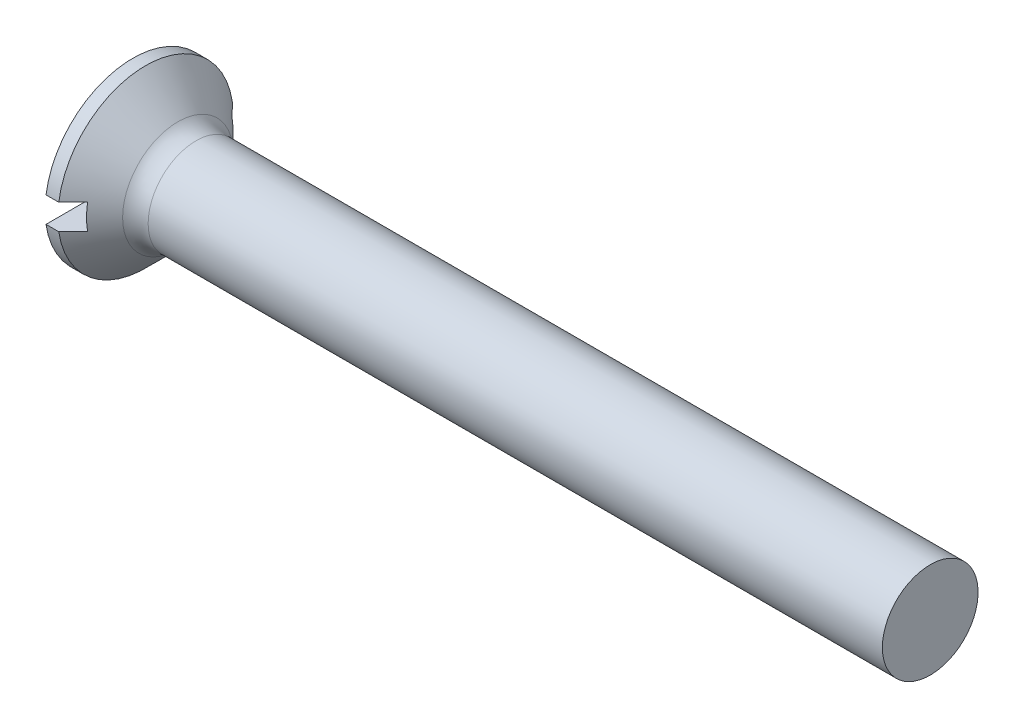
SolidWorks part; units mm, degrees
ref_plane "Plane1" through (0, 0, 0) normal (0, 0, 1) x (1, 0, 0)
ref_plane "Plane2" through (0, 0, 0) normal (0, 1, 0) x (1, 0, 0)
ref_plane "Plane3" through (0, 0, 0) normal (1, 0, 0) x (0, 0, -1)
sketch "BodySke" plane through (0, 0, 0) normal (0, 0, 1) x (1, 0, 0)
  line L0 (0, 0) -> (0, 2.75)
  line L1 (0, 2.75) -> (0.4, 2.75)
  line L2 (1.65, 1.5) -> (25, 1.5)
  line L3 (25, 1.5) -> (25, 0)
  line L4 (25, 0) -> (0, 0)
  line L5 (-6.35, 0) -> (82.55, 0) construction
  line L6 (1.65, -1.5) -> (25, -1.5) construction
  line L7 (0.4, -2.75) -> (1.65, -1.5) construction
  line L8 (0.4, 2.75) -> (1.65, 1.5)
  line L9 (0, -2.75) -> (0.4, -2.75) construction
  line L10 (2.15, 3.0875) -> (2.15, -6.4375) construction
  line L11 (0, 6.35) -> (0, -3.175) construction
  dimension "Diameter" = 3
  dimension "Length" = 25
  dimension "Head_ht" = 1.65
  dimension "Head_dia" = 5.5
  dimension "Head_ang" = 90
  dimension "D6" = 0.4
  dimension "Advance" = 0.5
  dimension "Thread_nom" = 25
revolve "Base-Revolve" add sketch "BodySke" angle 360 about L5
fillet "Fillet1" radius 0.8 1 edges at (1.65, 0, 1.5)
sketch "Sketch2" plane through (0, 0, 0) normal (-1, 0, 0) x (0, 0, 1)
  line L0 (-2.75, -0.4) -> (2.75, -0.4)
  line L1 (-2.75, -0.4) -> (-2.75, 0.4)
  line L2 (2.75, 0.4) -> (-2.75, 0.4)
  line L3 (2.75, 0.4) -> (2.75, -0.4)
  dimension "D1" = 0.4
  dimension "Slot_width" = 0.8
  dimension "D2" = 5.5
  dimension "D3" = 2.75
extrude "Slot" cut sketch "Sketch2" against normal blind 0.85
sketch "ThdSchSke" plane through (0, 0, 0) normal (0, 0, 1) x (1, 0, 0)
  line L0 (2.15, -1.2195) -> (1.9536, -1.5)
  line L1 (2.15, -1.2195) -> (2.3464, -1.5)
  line L2 (2.3464, -1.5) -> (2.3464, -1.875)
  line L3 (-3.175, 0) -> (5.1513, 0) construction
  line L5 (2.3464, -1.875) -> (1.9536, -1.875)
  line L6 (1.9536, -1.875) -> (1.9536, -1.5)
  line L7 (0, 2.75) -> (0, 0.4) construction
  dimension "Thread_minor" = 2.439
  dimension "Diameter" = 3
  dimension "Start" = 2.15
  dimension "SideAngle" = 55
  dimension "VeeAngle" = 70
  dimension "Overcut" = 3.75
revolve "ThreadSchematic" [suppressed] cut sketch "ThdSchSke" angle 360 about L3
pattern_linear "ThdSchPat" [suppressed]
equation "\"D1@Sketch2\" = \"Slot_width@Sketch2\" / 2"
equation "\"D2@Sketch2\" = \"Head_dia@BodySke\""
equation "\"D3@Sketch2\" = \"D2@Sketch2\" / 2"
equation "\"Thread_length@ThreadCosmetic\" = ((sgn( (\"Length@BodySke\" - \"Advance@BodySke\" * 1.0 - \"Head_ht@BodySke\" ) - \"Thread_nom@BodySke\" )-1)*( (\"Length@BodySke\" - \"Advance@BodySke\" * 1.0 - \"Head_ht@BodySke\" "
equation "\"Thread_minor@ThdSchSke\" = \"Thread_minor@ThreadCosmetic\""
equation "\"Diameter@ThdSchSke\" = \"Diameter@BodySke\""
equation "\"Overcut@ThdSchSke\" = \"Diameter@BodySke\" * 1.25"
equation "\"Start@ThdSchSke\" = 0.000001 + \"Length@BodySke\" - \"Thread_length@ThreadCosmetic\"  '---Countersunk---"
equation "\"Num_threads@ThdSchPat\" = int( \"Thread_length@ThreadCosmetic\" / \"Advance@BodySke\" + 0.999 )  + 1"
equation "\"Advance@ThdSchPat\" = \"Thread_length@ThreadCosmetic\" /  (\"Num_threads@ThdSchPat\" - 1) 'relax it"
